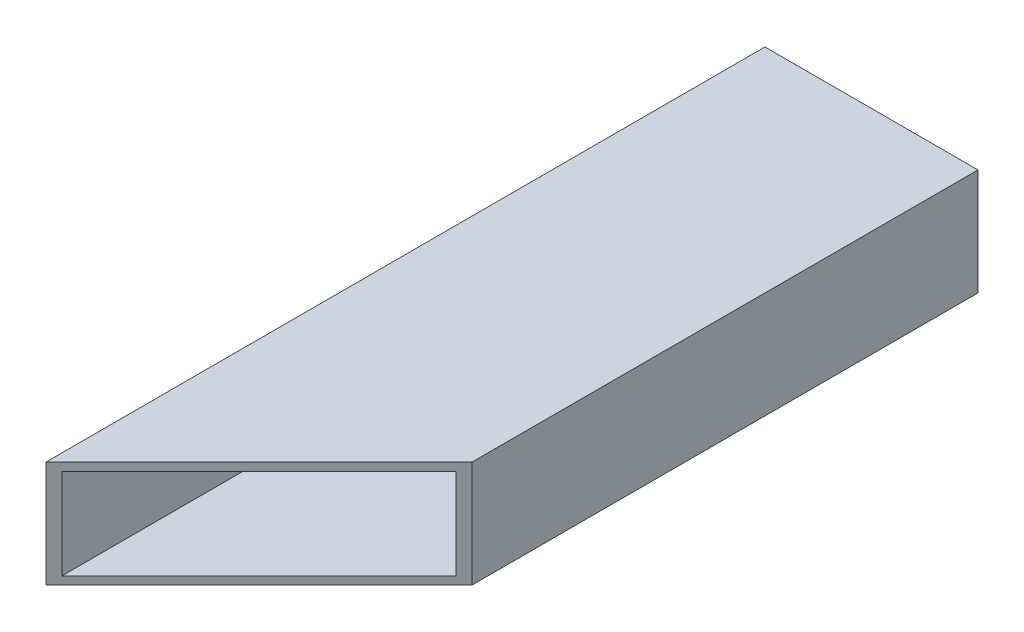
SolidWorks part; units mm, degrees
ref_plane "Plan de face" through (0, 0, 0) normal (0, 0, 1) x (1, 0, 0)
ref_plane "Plan de dessus" through (0, 0, 0) normal (0, 1, 0) x (1, 0, 0)
ref_plane "Plan de droite" through (0, 0, 0) normal (1, 0, 0) x (0, 0, -1)
sketch "Esquisse1" plane through (0, 0, 0) normal (0, 0, 1) x (1, 0, 0)
  line L1 (0, 0) -> (80, 0)
  line L2 (0, 0) -> (0, 40)
  line L3 (0, 40) -> (80, 40)
  line L4 (80, 0) -> (80, 40)
  line L5 (3, 37) -> (77, 37)
  line L6 (3, 37) -> (3, 3)
  line L7 (3, 3) -> (77, 3)
  line L8 (77, 37) -> (77, 3)
  dimension "D1" = 80
  dimension "D2" = 40
  dimension "D3" = 3
  dimension "D4" = 3
  dimension "D5" = 3
  dimension "D6" = 3
extrude "Extrusion1" add sketch "Esquisse1" along normal blind 270
ref_plane "Plan1" through (0, 0, 135) normal (0, 0, 1) x (1, 0, 0)
chamfer "Chanfrein2" distance 80 1 edges at (80, 20, 270)
